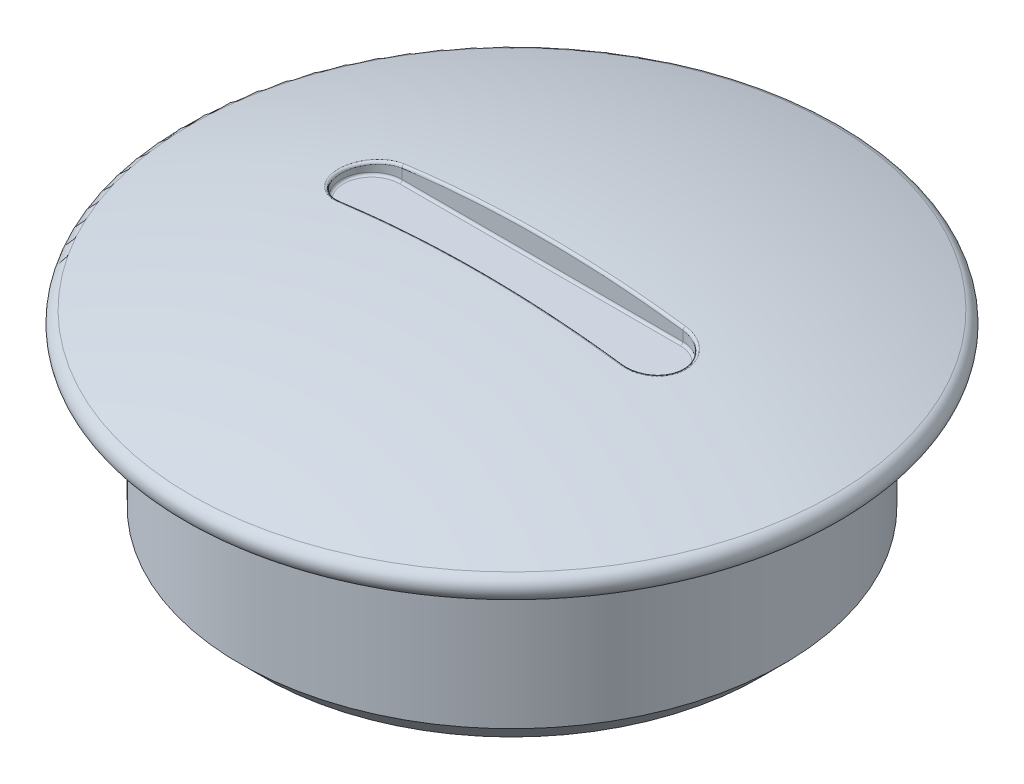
SolidWorks part; units mm, degrees
ref_plane "Face" through (0, 0, 0) normal (0, 0, 1) x (1, 0, 0)
ref_plane "Dessus" through (0, 0, 0) normal (0, 1, 0) x (1, 0, 0)
ref_plane "Droite" through (0, 0, 0) normal (1, 0, 0) x (0, 0, -1)
sketch "Esquisse1" plane through (0, 0, 0) normal (0, 0, 1) x (1, 0, 0)
  line L0 (0, -9.3186) -> (0, 6.735) construction
  line L1 (11.15, 0) -> (13, 0)
  line L2 (0, 3) -> (5.2546, 3) construction
  line L3 (11.15, 0) -> (11.15, -7)
  line L4 (11.15, -7) -> (9.15, -7)
  line L5 (9.15, -7) -> (9.15, -0.5)
  line L6 (8.65, 0) -> (0, 0)
  line L7 (0, 0) -> (0, 3)
  arc A0 (13, 0) -> (13.1503, 0.9769) centre (13, 0.5) ccw
  arc A1 (13.1503, 0.9769) -> (0, 3) centre (0, -40.75) ccw
  arc A2 (8.65, 0) -> (9.15, -0.5) centre (8.65, -0.5) cw
  dimension "D2" = 3
  dimension "D3" = 0.5
  dimension "D4" = 27
  dimension "D7" = 0.5
  dimension "D1" = 10
  dimension "D5" = 22.3
  dimension "D6" = 2
revolve "Révolution1" add sketch "Esquisse1" angle 360 about L0
ref_plane "Plan1" through (0, 3, 0) normal (0, 1, 0) x (-1, 0, 0)
sketch "Esquisse2" plane through (0, 3, 0) normal (0, 1, 0) x (-1, 0, 0)
  line L0 (6.1931, 0) -> (-6.2887, 0) construction
  line L1 (-5.75, 1.25) -> (5.75, 1.25)
  line L2 (5.75, -1.25) -> (-5.75, -1.25)
  line L3 (0, 0) -> (0, 3.9932) construction
  arc A0 (5.75, 1.25) -> (5.75, -1.25) centre (5.75, 0) cw
  arc A1 (-5.75, -1.25) -> (-5.75, 1.25) centre (-5.75, 0) cw
  dimension "D1" = 14
  dimension "D2" = 2.5
extrude "Enlèv. mat.-Extru.1" cut sketch "Esquisse2" against normal blind 1
fillet "Congé1" radius 0.1 8 edges at (-7, 2, 0) (0, 2, -1.25) (7, 2, 0) (-6.9906, 2.4376, 0.1531) (0, 2.9821, -1.25) (6.9906, 2.4376, -0.1531) (0, 2, 1.25) (0, 2.9821, 1.25)
chamfer "Chanfrein1" distance 1 angle 45 1 edges at (0, -7, -11.15)
